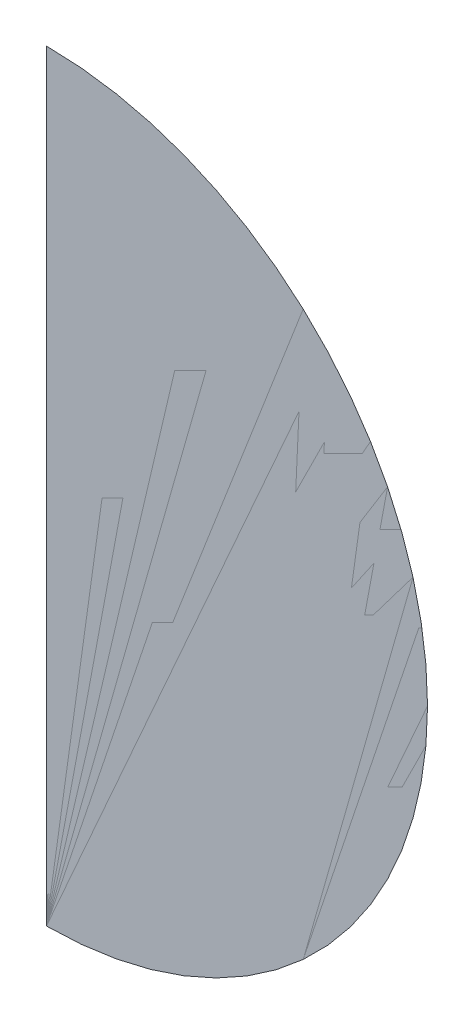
SolidWorks part; units mm, degrees
ref_plane "Front Plane" through (0, 0, 0) normal (0, 0, 1) x (1, 0, 0)
ref_plane "Top Plane" through (0, 0, 0) normal (0, 1, 0) x (1, 0, 0)
ref_plane "Right Plane" through (0, 0, 0) normal (1, 0, 0) x (0, 0, -1)
sketch "Sketch1" plane through (0, 0, 0) normal (0, 0, 1) x (1, 0, 0)
  line L0 (0, -25000) -> (0, 25000) construction
  line L1 (0, 13000) -> (0, -13000)
  arc A0 (0, -13000) -> (0, 13000) centre (0, 0) ccw
revolve "Revolve1" add sketch "Sketch1" angle 360 about L0
